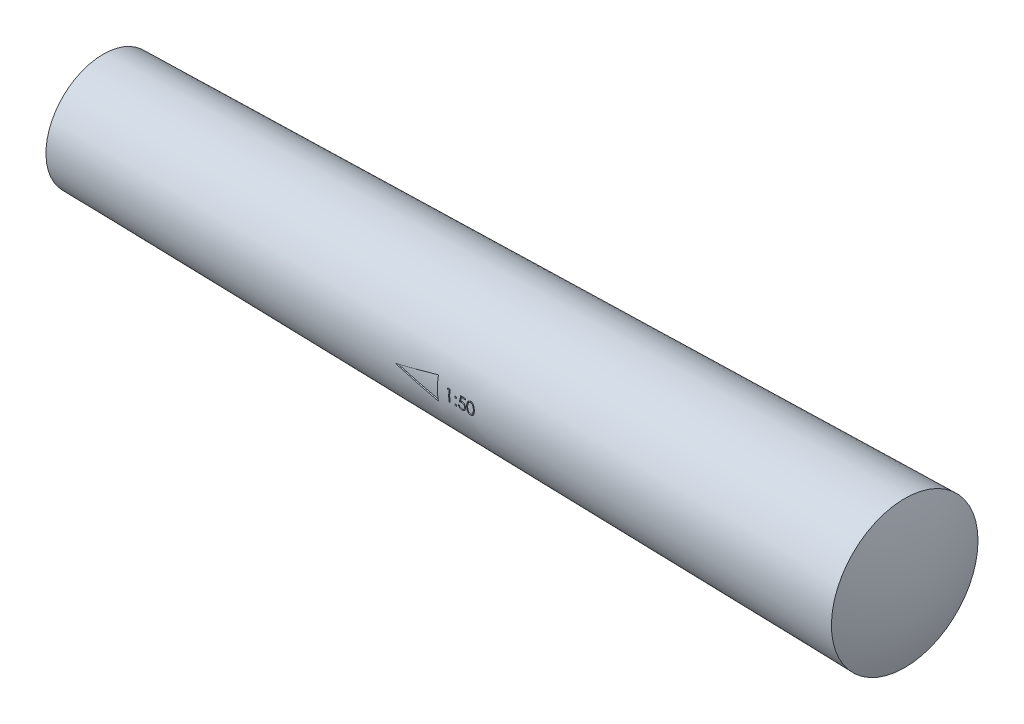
SolidWorks part; units mm, degrees
ref_plane "Front Plane" through (0, 0, 0) normal (0, 0, 1) x (1, 0, 0)
ref_plane "Top Plane" through (0, 0, 0) normal (0, 1, 0) x (1, 0, 0)
ref_plane "Right Plane" through (0, 0, 0) normal (1, 0, 0) x (0, 0, -1)
sketch "Sketch1" plane through (0, 0, 0) normal (1, 0, 0) x (0, 0, -1)
  circle A0 centre (0, 0) radius 5
  dimension "D1" = 10
extrude "Extrude1" add sketch "Sketch1" along normal mid plane 70
draft "Draft1" type of draft neutral plane draft angle 1.146 faces to draft 1 parameters "D1"=1.146
sketch "Sketch2" plane through (0, 0, 0) normal (0, 0, 1) x (1, 0, 0)
  line L0 (-35, 0) -> (-35, 5)
  line L1 (-35, 5) -> (-35, -5) construction
  line L2 (-35, 0) -> (-36.2, 0)
  line L3 (-36.2, 0) -> (-36.2, -5.7) construction
  line L4 (35, 0) -> (35, 6.4)
  line L5 (35, -6.4) -> (35, 6.4) construction
  line L6 (35, 0) -> (36.2, 0)
  line L7 (36.2, 0) -> (36.2, -5.7) construction
  line L8 (-35, -5) -> (35, -6.4) construction
  arc A0 (-36.2, 0) -> (-35, 5) centre (-25.1833, 0) cw
  arc A1 (36.2, 0) -> (35, 6.4) centre (18.5331, 0) ccw
  point P14 (0, -5.7)
revolve "Revolve1" add sketch "Sketch2" angle 360 about L2
sketch "Sketch5" plane through (0, 0, 0) normal (0, 0, 1) x (1, 0, 0)
  line L0 (0, 5.7) -> (0, -5.7) construction
  line L1 (35, 6.4) -> (-35, 5) construction
  line L2 (-35, -5) -> (35, -6.4) construction
ref_plane "Plane2" through (0, 0, 0) normal (-0.02, 0, 0.9998) x (0.9998, 0, 0.02)
sketch "Sketch6" plane through (0, 0, 0) normal (-0.02, 0, 0.9998) x (0.9998, 0, 0.02)
  line L0 (0, 0) -> (0, 1)
  line L1 (0, 5.7) -> (0, -5.7) construction
  line L2 (0, 1) -> (-3.7321, 0)
  line L3 (-3.7321, 0) -> (0, -1)
  line L4 (0, -1) -> (0, 0)
  line L5 (0, -0.5) -> (4, -0.5) construction
  text T0 "1:50" font "Century Gothic" height 1
  dimension "D1" = 2
  dimension "D2" = 30
  dimension "D3" = 4
wrap "Wrap2" sketch "Sketch6" wrap type deboss source sketch "Sketch6" thickness 0.1 parameters "D1"=0.1
equation "\"D2@Sketch2\" = \"D1@Sketch2\""
